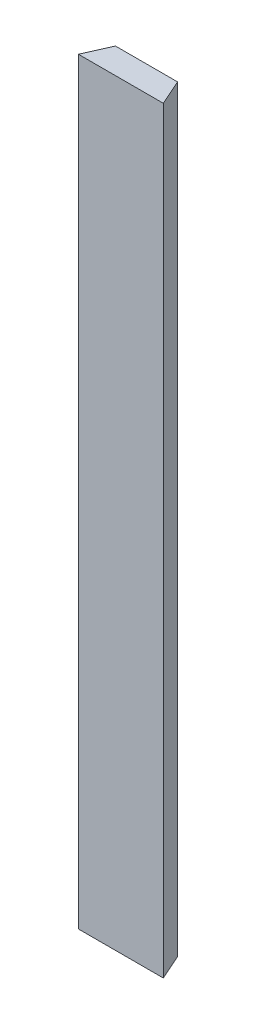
SolidWorks part; units mm, degrees
ref_plane "Front" through (0, 0, 0) normal (0, 0, 1) x (1, 0, 0)
ref_plane "Top" through (0, 0, 0) normal (0, 1, 0) x (1, 0, 0)
ref_plane "Right" through (0, 0, 0) normal (1, 0, 0) x (0, 0, -1)
sketch "Sketch1" plane through (0, 0, 0) normal (0, 1, 0) x (1, 0, 0)
  line L0 (0, 0) -> (136.525, 0)
  line L5 (136.525, 0) -> (118.2687, 41.275)
  line L6 (118.2687, 41.275) -> (18.2563, 41.275)
  line L7 (18.2563, 41.275) -> (0, 0)
  dimension "D1" = 136.525
  dimension "D2" = 100.0125
  dimension "D3" = 41.275
extrude "Boss-Extrude1" add sketch "Sketch1" along normal blind 1219.2
